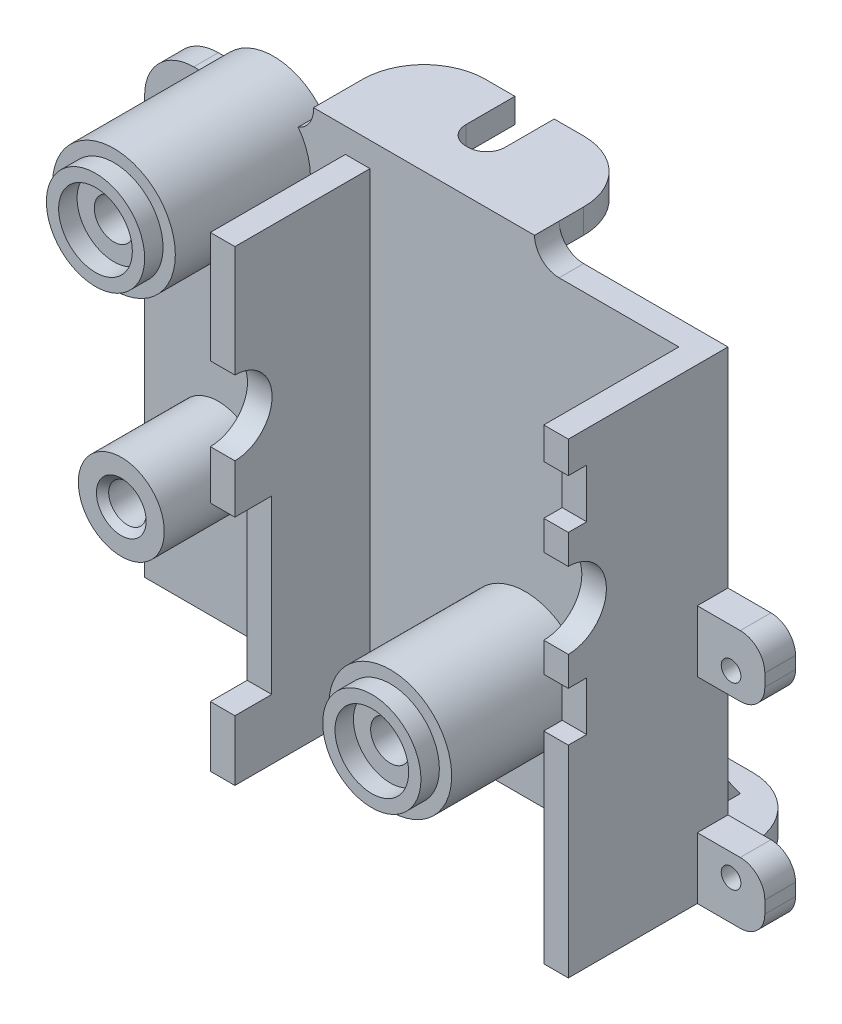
SolidWorks part; units mm, degrees
ref_plane "Face" through (0, 0, 0) normal (0, 0, 1) x (1, 0, 0)
ref_plane "Dessus" through (0, 0, 0) normal (0, 1, 0) x (1, 0, 0)
ref_plane "Droite" through (0, 0, 0) normal (1, 0, 0) x (0, 0, -1)
sketch "Esquisse1" plane through (0, 0, 0) normal (0, 0, 1) x (1, 0, 0)
  line L0 (-18.636, 0) -> (40.6725, 0) construction
  line L1 (0, 13.4516) -> (0, -31.9474) construction
  line L2 (-13.58, -13.58) -> (12.9107, -13.58) construction
  line L3 (11, 10.3689) -> (11, -7.2863) construction
  line L4 (12.35, 12.5556) -> (12.35, -11.4741) construction
  line L5 (37.5, 12.5556) -> (37.5, -10.7539) construction
  line L6 (-16.5535, -25.5) -> (42.4584, -25.5) construction
  line L7 (-16.0297, -27.5) -> (41.191, -27.5) construction
  line L8 (-6, 14.3889) -> (-6, -30.5277) construction
  line L9 (12.35, 10.45) -> (38.7737, 10.45) construction
  line L10 (11.7976, -10.45) -> (39.5594, -10.45) construction
  line L11 (39.5, 11.377) -> (39.5, -30.9205) construction
  line L12 (-10.1369, 12.5) -> (39.5, 12.5) construction
  line L14 (-6, 12.5) -> (39.5, 12.5)
  line L15 (-6, 12.5) -> (-6, -25.5)
  line L16 (-6, -25.5) -> (39.5, -25.5)
  line L17 (39.5, 12.5) -> (39.5, -25.5)
  circle A0 centre (0, -13.58) radius 11.5 construction
  circle A1 centre (0, -13.58) radius 1.5
extrude "Base-Extrusion" add sketch "Esquisse1" along normal mid plane 26
sketch "Esquisse5" plane through (0, 12.5, 0) normal (0, 1, 0) x (-1, 0, 0)
  line L0 (-12.35, -16.3279) -> (-12.35, 15.7701) construction
  line L1 (-10.35, -15.9222) -> (-10.35, 14.6545) construction
  line L2 (-37.5, -14.3503) -> (-37.5, 16.7842) construction
  line L3 (-39.5, -13.7925) -> (-39.5, 16.3786) construction
  line L4 (-40.8108, 11) -> (9.1448, 11) construction
  line L5 (-41.2165, -11) -> (8.3249, -11) construction
  line L7 (-37.5, 11) -> (-12.35, 11)
  line L8 (-37.5, 11) -> (-37.5, -11)
  line L9 (-37.5, -11) -> (-12.35, -11)
  line L10 (-12.35, 11) -> (-12.35, -11)
  line L11 (-10.35, 11) -> (8.7031, 11)
  line L12 (-10.35, 11) -> (-10.35, -11)
  line L13 (-10.35, -11) -> (8.7031, -11)
  line L14 (8.7031, 11) -> (8.7031, -11)
extrude "Enlèv. mat.-Extru.6" cut sketch "Esquisse5" against normal blind 40
sketch "Esquisse3" plane through (0, 0, 13) normal (0, 0, 1) x (1, 0, 0)
  circle A0 centre (0, -13.58) radius 3.5
extrude "Boss.-Extru.1" add sketch "Esquisse3" against normal blind 25
sketch "Esquisse4" plane through (0, 0, 13) normal (0, 0, 1) x (1, 0, 0)
  circle A0 centre (0, -13.58) radius 1.525
extrude "Enlèv. mat.-Extru.2" cut sketch "Esquisse4" against normal through all
sketch "Esquisse6" plane through (39.5, 0, 0) normal (1, 0, 0) x (0, 0, -1)
  line L0 (-13.8762, 0) -> (18.6073, 0) construction
  line L1 (0, 14.021) -> (0, -22.5589) construction
  circle A0 centre (0, 0.42) radius 3.025
extrude "Enlèv. mat.-Extru.3" cut sketch "Esquisse6" against normal through all
sketch "Esquisse7" plane through (39.5, 0, 0) normal (1, 0, 0) x (0, 0, -1)
  circle A0 centre (0, 0.42) radius 3.1
extrude "Enlèv. mat.-Extru.4" cut sketch "Esquisse7" against normal blind 3
sketch "Esquisse8" plane through (0, -25.5, 0) normal (0, -1, 0) x (1, 0, 0)
  line L0 (-6, 21.1962) -> (-6, -20.9902) construction
  line L1 (39.5, 20.4108) -> (39.5, -20.9902) construction
  line L2 (41.0671, -20) -> (-8.3785, -20) construction
  line L3 (-7.8207, 20) -> (40.3571, 20) construction
  line L5 (-6, 20) -> (39.5, 20)
  line L6 (-6, 20) -> (-6, 11.9399)
  line L7 (-6, 11.9399) -> (39.5, 11.9399)
  line L8 (39.5, 20) -> (39.5, 11.9399)
  line L9 (-6, -20) -> (39.5, -20)
  line L10 (-6, -20) -> (-6, -11.5095)
  line L11 (-6, -11.5095) -> (39.5, -11.5095)
  line L12 (39.5, -20) -> (39.5, -11.5095)
extrude "Boss.-Extru.2" add sketch "Esquisse8" against normal blind 2
sketch "Esquisse9" plane through (0, 12.5, 0) normal (0, 1, 0) x (-1, 0, 0)
  line L0 (6.6791, -3.1) -> (-6.4741, -3.1) construction
  line L1 (7.282, 3.1) -> (-7.5154, 3.1) construction
  line L3 (6.6791, -3.1) -> (-4.7203, -3.1)
  line L4 (6.6791, -3.1) -> (6.6791, 3.1)
  line L5 (6.6791, 3.1) -> (-4.7203, 3.1)
  line L6 (-4.7203, -3.1) -> (-4.7203, 3.1)
extrude "Enlèv. mat.-Extru.5" cut sketch "Esquisse9" against normal blind 32
sketch "Esquisse12" plane through (0, 0, 0) normal (0, 0, 1) x (1, 0, 0)
  line L0 (-4.6513, 9.5) -> (15.1881, 9.5) construction
  line L1 (18.2023, -16) -> (33.4929, -16) construction
  line L2 (25, -8.6922) -> (25, -25.0789) construction
  line L3 (2.5, 14.9287) -> (2.5, -0.5811) construction
  circle A0 centre (2.5, 9.5) radius 5
  circle A1 centre (25, -16) radius 5
extrude "Boss.-Extru.3" add sketch "Esquisse12" along normal mid plane 26
sketch "Esquisse13" plane through (0, 0, 0) normal (0, 0, 1) x (1, 0, 0)
  circle A0 centre (2.5, 9.5) radius 1.6
  circle A1 centre (25, -16) radius 1.6
extrude "Enlèv. mat.-Extru.8" cut sketch "Esquisse13" against normal mid plane 32
sketch "Esquisse14" plane through (0, -23.5, 0) normal (0, 1, 0) x (-1, 0, 0)
  line L0 (8.0853, 0) -> (-43.1429, 0) construction
  line L1 (-4, -22.6142) -> (-4, -6.692) construction
  line L2 (-39.5, -22.6142) -> (-39.5, -10.961) construction
  line L3 (-16.75, -22.0374) -> (-16.75, -8.8265) construction
  line L4 (-7.2, -22.0374) -> (-7.2, -8.8265) construction
  line L5 (2.9509, -14.5) -> (-11.9906, -14.5) construction
  line L6 (-26.3, -21.5758) -> (-26.3, -16)
  line L7 (-4, -21.5758) -> (-7.2, -21.5758)
  line L8 (-4, -21.5758) -> (-4, -16)
  line L9 (-5.5, -14.5) -> (-5.7, -14.5)
  line L10 (-7.2, -21.5758) -> (-7.2, -16)
  line L11 (-28, -14.5) -> (-27.8, -14.5)
  line L12 (-29.5, -21.5758) -> (-29.5, -16)
  line L13 (-29.5, -21.5758) -> (-26.3, -21.5758)
  line L14 (-29.5, 21.5758) -> (-26.3, 21.5758)
  line L15 (-29.5, 21.5758) -> (-29.5, 16)
  line L16 (-28, 14.5) -> (-27.8, 14.5)
  line L17 (-7.2, 21.5758) -> (-7.2, 16)
  line L18 (-5.5, 14.5) -> (-5.7, 14.5)
  line L19 (-4, 21.5758) -> (-4, 16)
  line L20 (-4, 21.5758) -> (-7.2, 21.5758)
  line L21 (-26.3, 21.5758) -> (-26.3, 16)
  arc A0 (-5.5, -14.5) -> (-4, -16) centre (-5.5, -16) cw
  arc A1 (-7.2, -16) -> (-5.7, -14.5) centre (-5.7, -16) cw
  arc A2 (-26.3, -16) -> (-27.8, -14.5) centre (-27.8, -16) ccw
  arc A3 (-28, -14.5) -> (-29.5, -16) centre (-28, -16) ccw
  arc A4 (-28, 14.5) -> (-29.5, 16) centre (-28, 16) cw
  arc A5 (-26.3, 16) -> (-27.8, 14.5) centre (-27.8, 16) cw
  arc A6 (-7.2, 16) -> (-5.7, 14.5) centre (-5.7, 16) ccw
  arc A7 (-5.5, 14.5) -> (-4, 16) centre (-5.5, 16) ccw
  dimension "D1" = 1.5
extrude "Enlèv. mat.-Extru.9" cut sketch "Esquisse14" against normal through all
sketch "Esquisse15" plane through (39.5, 0, 0) normal (1, 0, 0) x (0, 0, -1)
  line L0 (-1.5, 10.2278) -> (-1.5, -10.1958) construction
  line L1 (1.5, 10.3335) -> (1.5, -9.7969) construction
  line L2 (-3.0488, 7.5) -> (3.8686, 7.5) construction
  line L3 (-5.6888, 0.42) -> (7.1769, 0.42) construction
  line L4 (-2.4473, 9.92) -> (3.3339, 9.92) construction
  line L5 (-2.4473, 5.92) -> (3.5389, 5.92) construction
  line L6 (-1.5, -5.08) -> (-1.5, -9.08)
  line L7 (1.5, 5.92) -> (-1.5, 5.92)
  line L8 (1.5, 5.92) -> (1.5, 9.92)
  line L9 (1.5, 9.92) -> (-1.5, 9.92)
  line L10 (-1.5, 5.92) -> (-1.5, 9.92)
  line L11 (1.5, -9.08) -> (-1.5, -9.08)
  line L12 (1.5, -5.08) -> (1.5, -9.08)
  line L13 (1.5, -5.08) -> (-1.5, -5.08)
extrude "Enlèv. mat.-Extru.10" cut sketch "Esquisse15" against normal blind 3
fillet "Congé1" radius 5 4 edges at (-6, -24.5, -20) (39.5, -24.5, -20) (-6, -24.5, 20) (39.5, -24.5, 20)
fillet "Congé2" radius 4 2 edges at (-6, 12.5, -12) (-6, 12.5, 12)
chamfer "Chanfrein1" distance 0.5 angle 45 4 edges at (-1.525, -13.58, -3.1) (1.525, -13.58, 3.1) (1.525, -13.58, -13) (1.525, -13.58, 13)
sketch "Esquisse16" plane through (0, 0, 0) normal (0, 0, 1) x (1, 0, 0)
  line L1 (-8.6726, 15.1395) -> (41.8545, 15.1395)
  line L2 (-8.6726, 15.1395) -> (-8.6726, -26.8516)
  line L3 (-8.6726, -26.8516) -> (41.8545, -26.8516)
  line L4 (41.8545, 15.1395) -> (41.8545, -26.8516)
extrude "Enlèv. mat.-Extru.12" cut sketch "Esquisse16" along normal blind 30
sketch "Esquisse17" plane through (0, 0, -13) normal (0, 0, -1) x (-1, 0, 0)
  line L0 (-30, -16) -> (-20.199, -16) construction
  line L1 (-25, -12.486) -> (-25, -20.8861) construction
  line L2 (-5.8684, 9) -> (2.1204, 9) construction
  line L3 (-2.5, 11.6857) -> (-2.5, 5.583) construction
  circle A0 centre (-25.0995, -16) radius 3.2
  circle A1 centre (-2.5, 9.5) radius 3.2
extrude "Enlèv. mat.-Extru.13" cut sketch "Esquisse17" against normal blind 11
sketch "Esquisse18" plane through (0, 0, 0) normal (0, 0, 1) x (1, 0, 0)
  line L0 (-4.1858, 9) -> (10.7968, 9) construction
  line L1 (2.5, 16.0119) -> (2.5, 3.4768) construction
  line L2 (18.8293, -16) -> (34.2125, -16) construction
  line L3 (25, -8.6554) -> (25, -23.4671) construction
  circle A0 centre (2.5, 9.5) radius 3
  circle A1 centre (25, -16) radius 3
  circle A2 centre (25, -16) radius 4
  circle A3 centre (2.5, 9.5) radius 4
extrude "Boss.-Extru.4" add sketch "Esquisse18" along normal blind 1.5
sketch "Esquisse20" plane through (0, 0, 0) normal (0, 0, 1) x (1, 0, 0)
  line L0 (0, -13.58) -> (19.4244, -13.58) construction
  line L1 (9.2982, -20.58) -> (14.8027, -20.58) construction
  line L2 (7.8441, -6.58) -> (16.1009, -6.58) construction
  line L4 (9.2982, -6.58) -> (13.4525, -6.58)
  line L5 (9.2982, -6.58) -> (9.2982, -20.58)
  line L6 (9.2982, -20.58) -> (13.4525, -20.58)
  line L7 (13.4525, -6.58) -> (13.4525, -20.58)
extrude "Enlèv. mat.-Extru.14" cut sketch "Esquisse20" against normal blind 3
sketch "Esquisse21" plane through (0, -23.5, 0) normal (0, 1, 0) x (-1, 0, 0)
  line L0 (-35.5, -10.467) -> (-35.5, -23.2453) construction
  line L1 (2, -12) -> (2, -22.8397) construction
  line L2 (0, -21.3691) -> (0, -12) construction
  line L3 (-33.5, -22.0283) -> (-33.5, -10.8219) construction
  line L4 (4.4712, -13) -> (-40.5065, -13) construction
  line L5 (4.0148, -18) -> (-41.0136, -18) construction
  line L7 (2, -18) -> (0, -18)
  line L8 (2, -18) -> (2, -12.6474)
  line L9 (2, -12.6474) -> (0, -12.6474)
  line L10 (0, -18) -> (0, -12.6474)
  line L11 (-33.5, -18) -> (-35.5, -18)
  line L12 (-33.5, -18) -> (-33.5, -12.6474)
  line L13 (-33.5, -12.6474) -> (-35.5, -12.6474)
  line L14 (-35.5, -18) -> (-35.5, -12.6474)
extrude "Boss.-Extru.5" add sketch "Esquisse21" along normal blind 7
chamfer "Chanfrein2" distance 7 distance2 5 2 edges at (-1, -16.5, -18) (34.5, -16.5, -18)
sketch "Esquisse22" plane through (0, 12.5, 0) normal (0, 1, 0) x (-1, 0, 0)
  line L0 (-30.0056, -13) -> (9.2362, -13) construction
  line L1 (-30.9899, -20) -> (-6.2505, -20) construction
  line L2 (0, -11.4483) -> (0, 11.4536) construction
  line L3 (-16.75, -24.3758) -> (-16.75, -1.3426) construction
  line L4 (-25.75, -21.7509) -> (-25.75, -7.8391) construction
  line L5 (-16.65, -14.5) -> (-16.85, -14.5)
  line L6 (-27.512, -11) -> (-7.563, -11) construction
  line L7 (-18.35, -16) -> (-18.35, -20)
  line L8 (-18.35, -20) -> (-25.75, -20)
  line L9 (-25.75, -20) -> (-25.75, -11)
  line L10 (-18.35, -21.1603) -> (-18.35, -14.0154) construction
  line L11 (-28, -14.5) -> (-14.5154, -14.5) construction
  line L12 (-25.75, -11) -> (-7.75, -11)
  line L13 (-7.75, -20) -> (-7.75, -11)
  line L14 (-15.15, -20) -> (-7.75, -20)
  line L15 (-15.15, -16) -> (-15.15, -20)
  arc A0 (-18.35, -16) -> (-16.85, -14.5) centre (-16.85, -16) cw
  arc A1 (-15.15, -16) -> (-16.65, -14.5) centre (-16.65, -16) ccw
  point P17 (-16.75, -13)
  point P18 (-16.75, -20)
  point P26 (-16.75, -14.5)
  point P31 (-16.75, -11)
  point P33 (-16.75, -14.5)
  dimension "D1" = 1.5
extrude "Boss.-Extru.6" add sketch "Esquisse22" along normal blind 2
fillet "Congé3" radius 2 3 edges at (7.75, 12.5, -12) (25.75, 12.5, -12) (25.75, 13.5, -11)
fillet "Congé4" radius 5 2 edges at (25.75, 13.5, -20) (7.75, 13.5, -20)
sketch "Esquisse23" plane through (0, 0, -13) normal (0, 0, -1) x (-1, 0, 0)
  text T0 "www.a4.fr" font "Arial" height 3.5
  point P1 (0, 0)
extrude "Boss.-Extru.7" add sketch "Esquisse23" along normal blind 0.3
sketch "Esquisse25" plane through (0, 0, -13) normal (0, 0, -1) x (-1, 0, 0)
  line L0 (-36.9245, -20.5) -> (-51.2569, -20.5) construction
  line L1 (-35.9898, -25.5) -> (-53.9573, -25.5) construction
  line L2 (-47.3622, -9.5) -> (-9.5, -9.5) construction
  line L3 (-47.3622, -4.5) -> (-36.9245, -4.5) construction
  line L4 (-39.469, 2.4971) -> (-39.469, -30.2183) construction
  line L5 (-45, 0.9911) -> (-45, -27.7776) construction
  line L6 (-42.25, -2.9035) -> (-42.25, -27.0506) construction
  line L7 (-43.5195, -7.7) -> (-41.3385, -7.7) construction
  line L8 (-42.9483, -22.3) -> (-41.3385, -22.3) construction
  line L10 (-45, -4.5) -> (-39.0536, -4.5)
  line L11 (-45, -4.5) -> (-45, -9.5)
  line L12 (-45, -9.5) -> (-39.0536, -9.5)
  line L13 (-39.0536, -4.5) -> (-39.0536, -9.5)
  line L14 (-45, -20.5) -> (-39.1574, -20.5)
  line L15 (-45, -20.5) -> (-45, -25.5)
  line L16 (-45, -25.5) -> (-39.1574, -25.5)
  line L17 (-39.1574, -20.5) -> (-39.1574, -25.5)
  circle A0 centre (-42.25, -7.7) radius 0.8
  circle A1 centre (-42.25, -22.3) radius 0.8
extrude "Boss.-Extru.8" add sketch "Esquisse25" against normal blind 2.5
fillet "Congé5" radius 2 4 edges at (45, -4.5, -11.75) (45, -9.5, -11.75) (45, -20.5, -11.75) (45, -25.5, -11.75)
